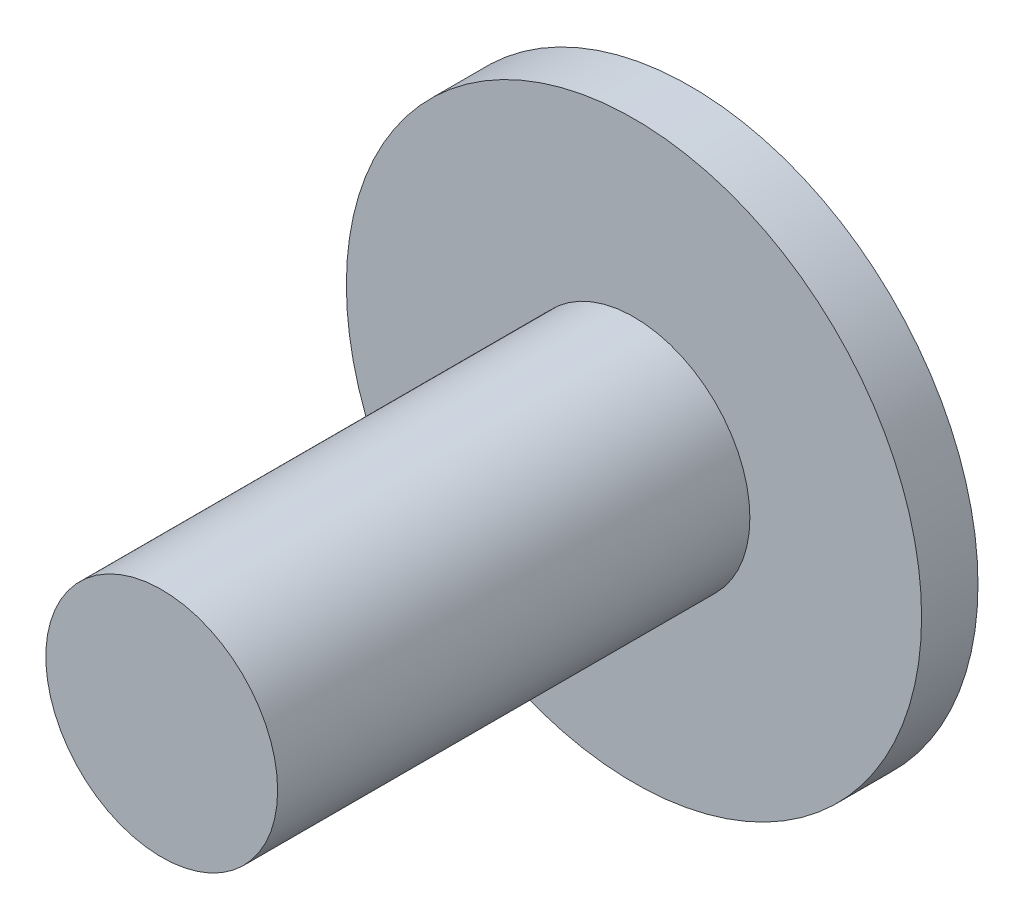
SolidWorks part; units mm, degrees
ref_plane "Front Plane" through (0, 0, 0) normal (0, 0, 1) x (1, 0, 0)
ref_plane "Top Plane" through (0, 0, 0) normal (0, 1, 0) x (1, 0, 0)
ref_plane "Right Plane" through (0, 0, 0) normal (1, 0, 0) x (0, 0, -1)
sketch "Sketch1" plane through (0, 0, 0) normal (0, 0, 1) x (1, 0, 0)
  circle A0 centre (0, 0) radius 24.6126
extrude "Boss-Extrude1" add sketch "Sketch1" along normal blind 4.826
sketch "Sketch2" plane through (0, 0, 0) normal (0, 0, 1) x (1, 0, 0)
  circle A0 centre (0, 0) radius 9.9187
extrude "Boss-Extrude2" add sketch "Sketch2" along normal blind 45.2374
sketch "Sketch3" plane through (0, 0, 0) normal (0, 0, 1) x (1, 0, 0)
  circle A0 centre (0, 0) radius 8.7122
extrude "Cut-Extrude1" cut sketch "Sketch3" along normal blind 9.525
